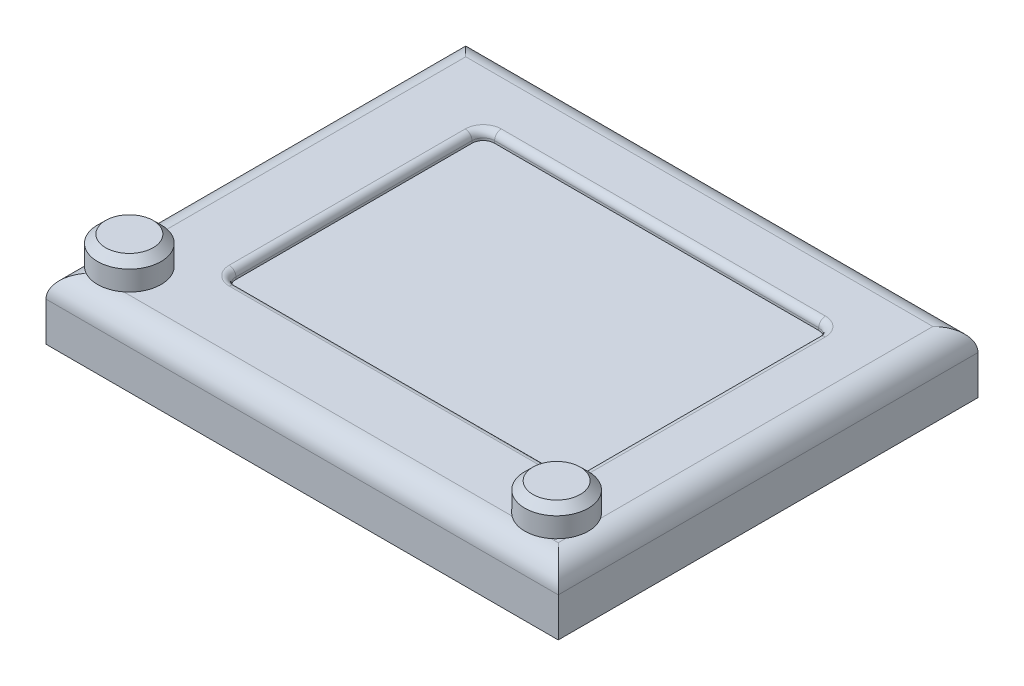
SolidWorks part; units mm, degrees
other "Body1"
other "Body4"
other "Body3"
ref_plane "Front" through (0, 0, 0) normal (0, 0, 1) x (1, 0, 0)
ref_plane "Top" through (0, 0, 0) normal (0, 1, 0) x (1, 0, 0)
ref_plane "Right" through (0, 0, 0) normal (1, 0, 0) x (0, 0, -1)
imported_body "Imported1"
imported_body "Imported2"
imported_body "Imported3"
other "Move Face1" parameters "D1"=0.7366
